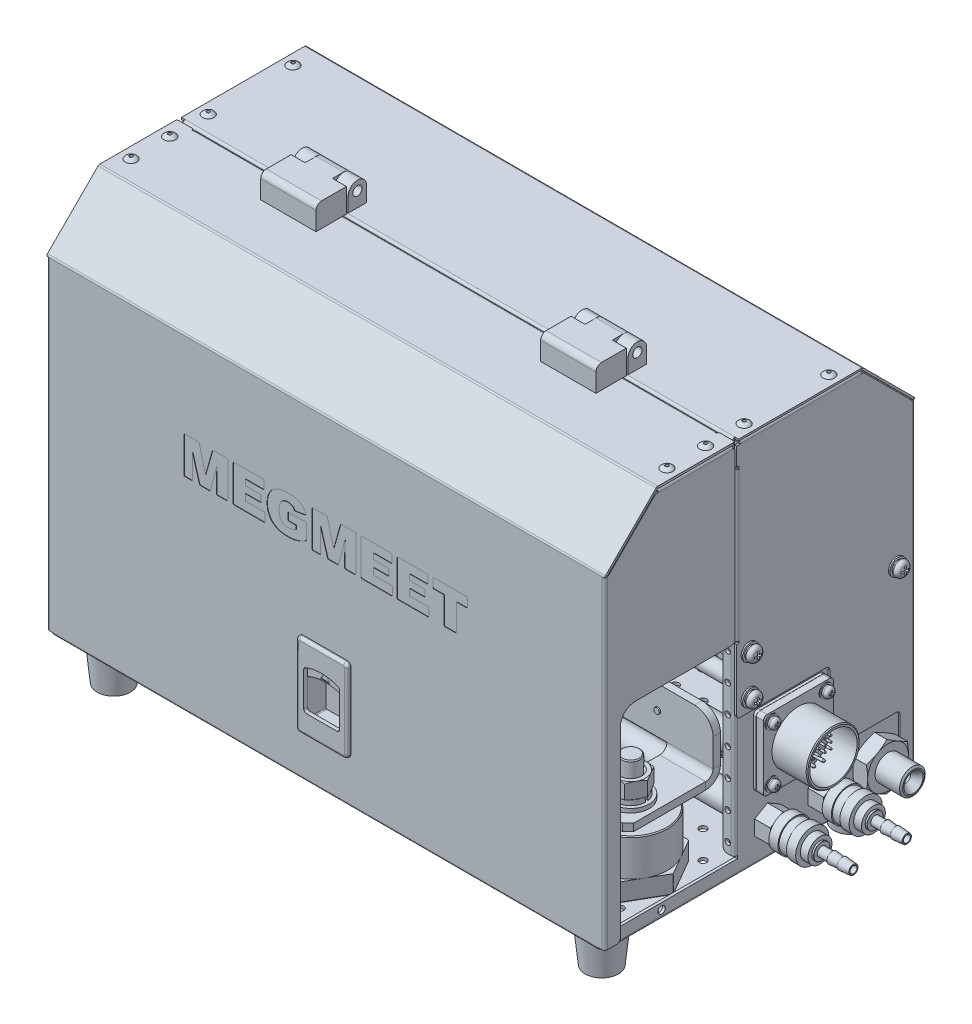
SolidWorks part; units mm, degrees
ref_plane "前视基准面" through (0, 0, 0) normal (0, 0, 1) x (1, 0, 0)
ref_plane "上视基准面" through (0, 0, 0) normal (0, 1, 0) x (1, 0, 0)
ref_plane "右视基准面" through (0, 0, 0) normal (1, 0, 0) x (0, 0, -1)
imported_body "Artsen_R29140061-ZB_二代机器人送丝机_水冷.igs"
sketch "草图2" plane through (0, 0, 0) normal (1, 0, 0) x (0, 0, -1)
  line L0 (40.5, -9.5) -> (-40.5, -9.5)
  line L1 (-80.8, -9.5) -> (80.8, -9.5) construction
  line L2 (-40.5, -9.5) -> (-40.5, -24.5)
  line L3 (-40.5, -24.5) -> (-38.5, -24.5)
  line L4 (-38.5, -24.5) -> (-38.5, -11.5)
  line L6 (-38.5, -11.5) -> (38.5, -11.5)
  line L7 (0, -9.5) -> (0, -11.5) construction
  line L8 (38.5, -24.5) -> (38.5, -11.5)
  line L9 (40.5, -24.5) -> (38.5, -24.5)
  line L10 (40.5, -9.5) -> (40.5, -24.5)
extrude "凸台-拉伸1" add sketch "草图2" along normal mid plane 190
